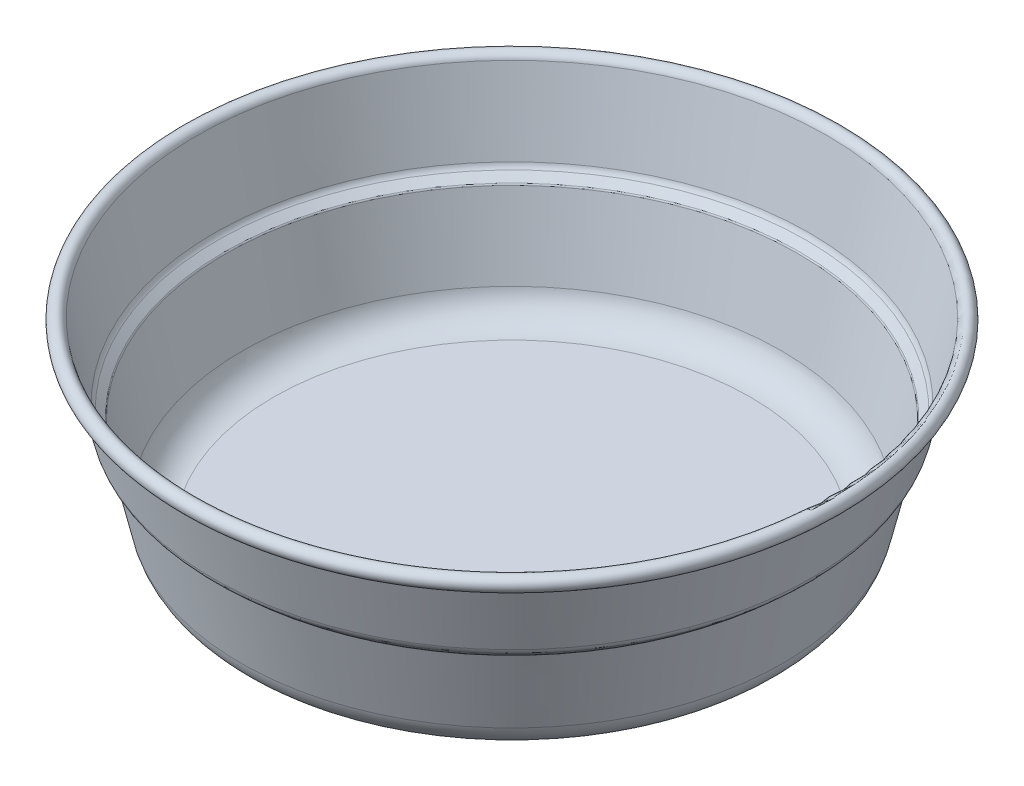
SolidWorks part; units mm, degrees
ref_plane "Plan de face" through (0, 0, 0) normal (0, 0, 1) x (1, 0, 0)
ref_plane "Plan de dessus" through (0, 0, 0) normal (0, 1, 0) x (1, 0, 0)
ref_plane "Plan de droite" through (0, 0, 0) normal (1, 0, 0) x (0, 0, -1)
sketch "Esquisse2" plane through (0, 0, 0) normal (0, 0, 1) x (1, 0, 0)
  line L0 (0, 0) -> (0, 89.314) construction
  line L1 (0, 0) -> (42.7292, 0)
  line L2 (48.5749, 4.6481) -> (51.6856, 18.0989)
  line L3 (53.6436, 20.3818) -> (56.7757, 33.9253)
  line L4 (55.75, 32.7) -> (71.4319, 32.7) construction
  line L5 (53.0237, 19.3376) -> (51.7476, 18.2033)
  arc A0 (57.75, 32.7) -> (56.7757, 33.9253) centre (57.75, 33.7) ccw
  arc A1 (42.7292, 0) -> (48.5749, 4.6481) centre (42.7292, 6) ccw
  arc A2 (51.6856, 18.0989) -> (51.7476, 18.2033) centre (51.8805, 18.0538) cw
  arc A3 (53.6436, 20.3818) -> (53.0237, 19.3376) centre (51.695, 20.8325) cw
  point P13 (47.5, 0)
  point P16 (51.7, 18.161)
  point P19 (53.5, 19.761)
  dimension "D6" = 117.5
  dimension "D7" = 34.7
  dimension "D8" = 6
  dimension "D9" = 0.2
  dimension "D10" = 2
  dimension "D11" = 1
  dimension "D1" = 47.5
  dimension "D2" = 1.6
  dimension "D3" = 103.4
  dimension "D4" = 107
  dimension "D5" = 111.5
revolve "Révol.-Mince1" add sketch "Esquisse2" angle 360 about L0
